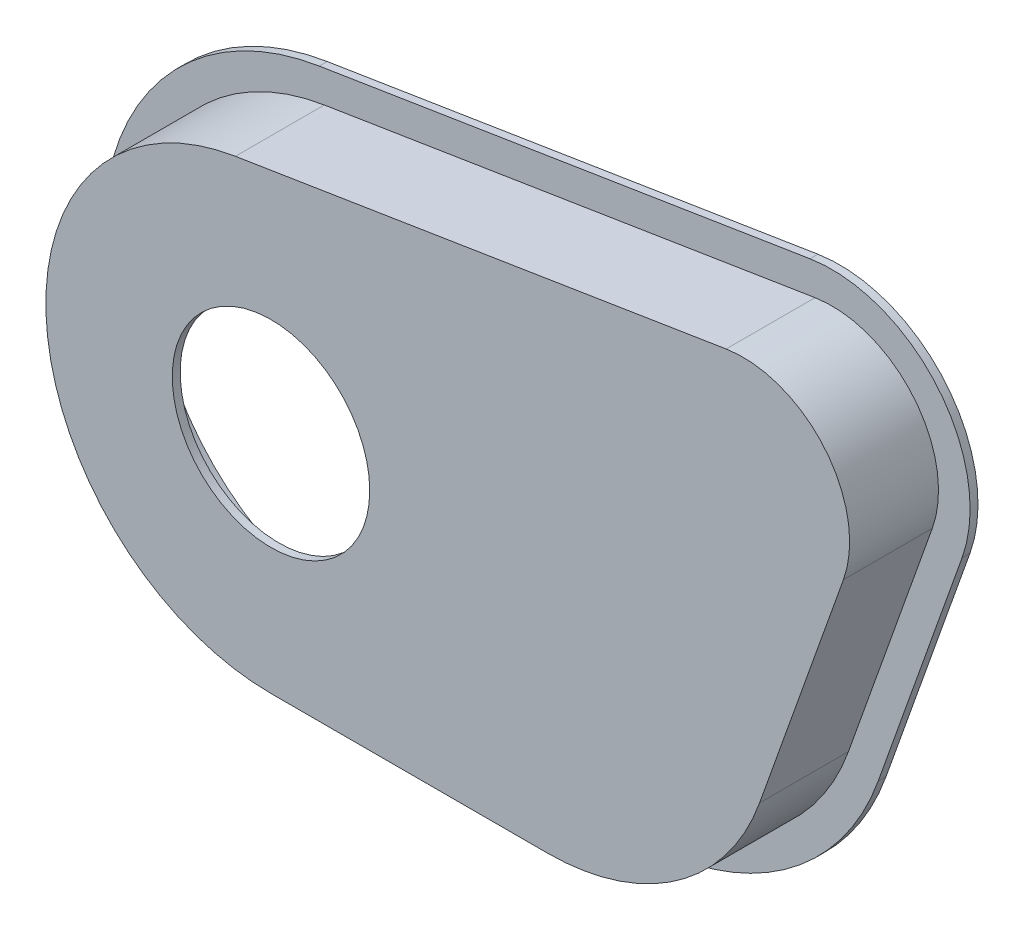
SolidWorks part; units mm, degrees
ref_plane "Front Plane" through (0, 0, 0) normal (0, 0, 1) x (1, 0, 0)
ref_plane "Top Plane" through (0, 0, 0) normal (0, 1, 0) x (1, 0, 0)
ref_plane "Right Plane" through (0, 0, 0) normal (1, 0, 0) x (0, 0, -1)
sketch "Sketch1" plane through (0, 0, 0) normal (0, 0, 1) x (1, 0, 0)
  line L0 (0, 0) -> (88.9, 0) construction
  line L1 (88.9, 0) -> (151.7618, 62.8618) construction
  line L2 (-11.0336, 68.973) -> (146.7465, 94.2132)
  line L3 (146.3453, 96.7213) -> (-11.4349, 71.4812)
  line L4 (184.0603, 51.3462) -> (157.0858, -24.3108)
  line L5 (181.6678, 52.1992) -> (154.6933, -23.4578)
  line L6 (0, -72.39) -> (88.9, -72.39)
  line L7 (88.9, -69.85) -> (0, -69.85)
  arc A0 (-11.0336, 68.973) -> (0, -69.85) centre (0, 0) ccw
  arc A1 (88.9, -69.85) -> (154.6933, -23.4578) centre (88.9, 0) ccw
  arc A2 (181.6678, 52.1992) -> (146.7465, 94.2132) centre (151.7618, 62.8618) ccw
  arc A3 (44.45, -57.1359) -> (155.3325, 28.7582) centre (88.9, 0) ccw construction
  arc A4 (-11.4349, 71.4812) -> (0, -72.39) centre (0, 0) ccw
  arc A5 (88.9, -72.39) -> (157.0858, -24.3108) centre (88.9, 0) ccw
  arc A6 (184.0603, 51.3462) -> (146.3453, 96.7213) centre (151.7618, 62.8618) ccw
  arc A7 (44.45, -53.8815) -> (151.4378, 31.1134) centre (88.9, 0) ccw construction
  arc A8 (151.4378, 31.1134) -> (120.0134, 62.5378) centre (151.7618, 62.8618) ccw construction
  arc A9 (155.3325, 28.7582) -> (117.6582, 66.4325) centre (151.7618, 62.8618) ccw construction
  arc A10 (117.6582, 66.4325) -> (44.45, 57.1359) centre (88.9, 0) ccw construction
  arc A11 (120.0134, 62.5378) -> (44.45, 53.8815) centre (88.9, 0) ccw construction
  arc A12 (44.45, 57.1359) -> (44.45, -57.1359) centre (0, 0) ccw construction
  arc A13 (44.45, 53.8815) -> (44.45, -53.8815) centre (0, 0) ccw construction
  dimension "D1" = 139.7
  dimension "D3" = 139.7
  dimension "D6" = 63.5
  dimension "D2" = 88.9
  dimension "D4" = 88.9
  dimension "D5" = 135
  dimension "D7" = 2.54
extrude "Boss-Extrude1" add sketch "Sketch1" along normal blind 28.575
sketch "Sketch4" plane through (0, 0, 28.575) normal (0, 0, 1) x (1, 0, 0)
  line L0 (-11.4349, 71.4812) -> (146.3453, 96.7213)
  line L1 (0, -72.39) -> (88.9, -72.39)
  line L2 (157.0858, -24.3108) -> (184.0603, 51.3462)
  arc A0 (-11.4349, 71.4812) -> (0, -72.39) centre (0, 0) ccw
  circle A1 centre (0, 0) radius 31.75
  arc A2 (184.0603, 51.3462) -> (146.3453, 96.7213) centre (151.7618, 62.8618) ccw
  arc A3 (88.9, -72.39) -> (157.0858, -24.3108) centre (88.9, 0) ccw
  dimension "D1" = 63.5
extrude "Boss-Extrude4" add sketch "Sketch4" along normal blind 2.54
sketch "Sketch5" plane through (0, 0, 0) normal (0, 0, -1) x (-1, 0, 0)
  line L0 (-146.3453, 96.7213) -> (11.4349, 71.4812)
  line L1 (-184.0603, 51.3462) -> (-157.0858, -24.3108)
  line L2 (-88.9, -72.39) -> (0, -72.39)
  line L3 (-144.7404, 106.7537) -> (13.0398, 81.5136)
  line L4 (-88.9, -82.55) -> (0, -82.55)
  line L5 (-193.6302, 47.9341) -> (-166.6557, -27.7228)
  arc A0 (0, -72.39) -> (11.4349, 71.4812) centre (0, 0) ccw
  arc A1 (-157.0858, -24.3108) -> (-88.9, -72.39) centre (-88.9, 0) ccw
  arc A2 (-146.3453, 96.7213) -> (-184.0603, 51.3462) centre (-151.7618, 62.8618) ccw
  arc A3 (0, -82.55) -> (13.0398, 81.5136) centre (0, 0) ccw
  arc A4 (-166.6557, -27.7228) -> (-88.9, -82.55) centre (-88.9, 0) ccw
  arc A5 (-144.7404, 106.7537) -> (-193.6302, 47.9341) centre (-151.7618, 62.8618) ccw
  dimension "D1" = 10.16
extrude "Boss-Extrude5" add sketch "Sketch5" against normal blind 2.54
